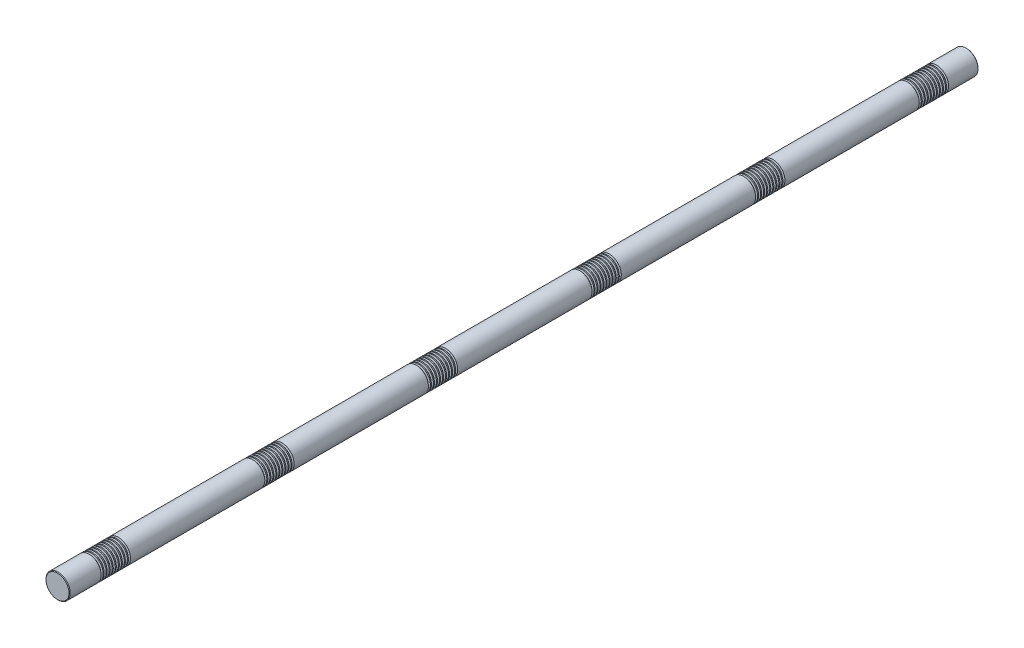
SolidWorks part; units mm, degrees
ref_plane "Front Plane" through (0, 0, 0) normal (0, 0, 1) x (1, 0, 0)
ref_plane "Top Plane" through (0, 0, 0) normal (0, 1, 0) x (1, 0, 0)
ref_plane "Right Plane" through (0, 0, 0) normal (1, 0, 0) x (0, 0, -1)
sketch "Sketch1" plane through (0, 0, 0) normal (0, 0, 1) x (1, 0, 0)
  circle A0 centre (0, 0) radius 40
  dimension "D1" = 80
extrude "Boss-Extrude1" add sketch "Sketch1" along normal mid plane 3000
chamfer "Chamfer1" distance 2 angle 45 2 edges at (40, 0, -1500) (40, 0, 1500)
sketch "Sketch2" plane through (0, 0, 0) normal (1, 0, 0) x (0, 0, -1)
  line L0 (1400.8038, 40) -> (1394.1962, 40)
  line L1 (1498, 40) -> (-1498, 40) construction
  line L2 (1394.1962, 40) -> (1395.8038, 34)
  line L3 (1395.8038, 34) -> (1399.1962, 34)
  line L4 (1399.1962, 34) -> (1400.8038, 40)
  line L5 (1500, -38) -> (1500, 38) construction
  point P4 (1397.5, 40)
  point P7 (1397.5, 34)
  point P8 (1400, 37)
  point P9 (1395, 37)
  dimension "D1" = 5
  dimension "D2" = 100
  dimension "D3" = 6
  dimension "D4" = 30
revolve "Cut-Revolve1" cut sketch "Sketch2" angle 360 about axis through (0, 0, 1500) along (0, 0, -1)
pattern_linear "LPattern1" count 10 spacing 10 along (0, 0, 1) of "Cut-Revolve1"
pattern_linear "LPattern2" count 6 spacing 540 along (0, 0, 1) of "Cut-Revolve1", "LPattern1"
